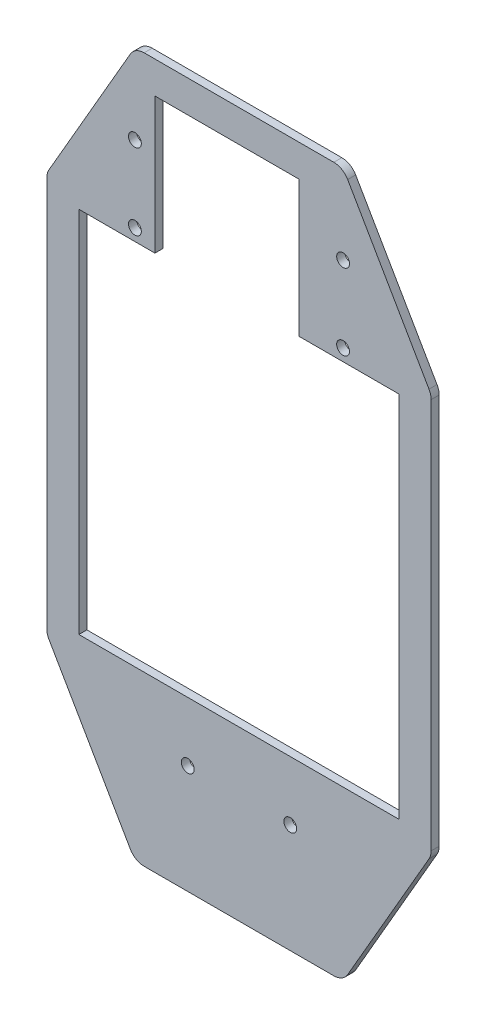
SolidWorks part; units mm, degrees
ref_plane "前视基准面" through (0, 0, 0) normal (0, 0, 1) x (1, 0, 0)
ref_plane "上视基准面" through (0, 0, 0) normal (0, 1, 0) x (1, 0, 0)
ref_plane "右视基准面" through (0, 0, 0) normal (1, 0, 0) x (0, 0, -1)
sketch "草图1" plane through (0, 0, 0) normal (0, 0, 1) x (1, 0, 0)
  line L0 (-98.6603, 121.6667) -> (-56.3212, 195)
  line L1 (47.661, 200) -> (-47.661, 200)
  line L2 (100, 116.6667) -> (100, -116.6667)
  line L3 (47.661, -200) -> (-47.661, -200)
  line L4 (-100, 116.6667) -> (-100, -116.6667)
  line L5 (-118.6603, 127.0257) -> (-67.8682, 215)
  line L6 (59.208, 220) -> (-59.208, 220)
  line L7 (0, 0) -> (0, 150) construction
  line L8 (0, 0) -> (100, 0) construction
  line L9 (98.6603, 121.6667) -> (56.3212, 195)
  line L10 (98.6603, -121.6667) -> (56.3212, -195)
  line L11 (-98.6603, -121.6667) -> (-56.3212, -195)
  line L12 (118.6603, 127.0257) -> (67.8682, 215)
  line L13 (120, 122.0257) -> (120, -122.0257)
  line L14 (118.6603, -127.0257) -> (67.8682, -215)
  line L15 (59.208, -220) -> (-59.208, -220)
  line L16 (-118.6603, -127.0257) -> (-67.8682, -215)
  line L17 (-120, 122.0257) -> (-120, -122.0257)
  line L18 (-120, -124.7051) -> (-64.9815, -220) construction
  line L19 (-120, 124.7051) -> (-120, -124.7051) construction
  line L20 (64.9815, -220) -> (-64.9815, -220) construction
  line L21 (120, -124.7051) -> (64.9815, -220) construction
  line L22 (120, 124.7051) -> (120, -124.7051) construction
  line L23 (-100, -119.3462) -> (-53.4345, -200) construction
  line L24 (53.4345, -200) -> (-53.4345, -200) construction
  line L25 (-100, 119.3462) -> (-100, -119.3462) construction
  line L26 (100, -119.3462) -> (53.4345, -200) construction
  line L27 (100, 119.3462) -> (100, -119.3462) construction
  line L28 (100, 119.3462) -> (53.4345, 200) construction
  line L29 (53.4345, 200) -> (-53.4345, 200) construction
  line L30 (-100, 119.3462) -> (-53.4345, 200) construction
  line L31 (120, 124.7051) -> (64.9815, 220) construction
  line L32 (64.9815, 220) -> (-64.9815, 220) construction
  line L33 (-120, 124.7051) -> (-64.9815, 220) construction
  arc A0 (-118.6603, -127.0257) -> (-120, -122.0257) centre (-110, -122.0257) cw
  arc A1 (-59.208, -220) -> (-67.8682, -215) centre (-59.208, -210) cw
  arc A2 (67.8682, -215) -> (59.208, -220) centre (59.208, -210) cw
  arc A3 (120, -122.0257) -> (118.6603, -127.0257) centre (110, -122.0257) cw
  arc A4 (-56.3212, -195) -> (-47.661, -200) centre (-47.661, -190) ccw
  arc A5 (-98.6603, -121.6667) -> (-100, -116.6667) centre (-90, -116.6667) cw
  arc A6 (56.3212, -195) -> (47.661, -200) centre (47.661, -190) cw
  arc A7 (98.6603, -121.6667) -> (100, -116.6667) centre (90, -116.6667) ccw
  arc A8 (56.3212, 195) -> (47.661, 200) centre (47.661, 190) ccw
  arc A9 (98.6603, 121.6667) -> (100, 116.6667) centre (90, 116.6667) cw
  arc A10 (-56.3212, 195) -> (-47.661, 200) centre (-47.661, 190) cw
  arc A11 (-98.6603, 121.6667) -> (-100, 116.6667) centre (-90, 116.6667) ccw
  arc A12 (118.6603, 127.0257) -> (120, 122.0257) centre (110, 122.0257) cw
  arc A13 (59.208, 220) -> (67.8682, 215) centre (59.208, 210) cw
  arc A14 (-67.8682, 215) -> (-59.208, 220) centre (-59.208, 210) cw
  arc A15 (-118.6603, 127.0257) -> (-120, 122.0257) centre (-110, 122.0257) ccw
  point P0 (0, 0)
  point P37 (-53.4345, -200)
  point P50 (53.4345, 200)
  dimension "D6" = 10
  dimension "D7" = 73.3333
  dimension "D1" = 400
  dimension "D2" = 200
  dimension "D3" = 100
  dimension "D4" = 200
  dimension "D5" = 20
  dimension "D8" = 30
  dimension "D9" = 73.3333
  dimension "D10" = 30
extrude "凸台-拉伸1" add sketch "草图1" along normal blind 30
sketch "草图2" plane through (0, 0, 30) normal (0, 0, 1) x (1, 0, 0)
  line L0 (-100, 130) -> (-70, 130)
  line L1 (-100, 116.6667) -> (-100, -116.6667) construction
  line L2 (-70, 130) -> (-70, 200)
  line L3 (47.661, 200) -> (-47.661, 200) construction
  line L4 (-70, 200) -> (-37.5, 200)
  line L5 (-37.5, 200) -> (-37.5, 115)
  line L6 (-37.5, 115) -> (-100, 115)
  line L7 (-100, 115) -> (-100, 130)
  line L8 (0, 0) -> (0, 200) construction
  dimension "D1" = 15
  dimension "D2" = 32.5
  dimension "D3" = 37.5
  dimension "D4" = 115
extrude "凸台-拉伸2" add sketch "草图2" against normal blind 40
mirror "镜向1" about plane through (0, 0, 0) normal (0, 1, 0) of "凸台-拉伸2"
mirror "镜向2" about plane through (0, 0, 0) normal (1, 0, 0) of "凸台-拉伸2", "镜向1"
sketch "草图3" plane through (0, 0, 0) normal (0, 0, -1) x (-1, 0, 0)
  line L0 (-100, 115) -> (100, 115)
  line L1 (100, 115) -> (100, -115)
  line L2 (100, -115) -> (-100, -115)
  line L3 (-100, -115) -> (-100, 115)
  line L8 (120, -122.0257) -> (120, 122.0257)
  line L10 (120, -122.0257) -> (120, 122.0257)
  line L12 (-120, 122.0257) -> (-120, -122.0257)
  line L13 (-118.6603, -127.0257) -> (-67.8682, -215)
  line L14 (118.6603, 127.0257) -> (67.8682, 215)
  line L20 (-120, 122.0257) -> (-120, -122.0257)
  line L21 (-118.6603, -127.0257) -> (-67.8682, -215)
  line L28 (118.6603, 127.0257) -> (67.8682, 215)
  line L29 (59.208, 220) -> (-59.208, 220)
  line L30 (59.208, 220) -> (-59.208, 220)
  line L31 (-67.8682, 215) -> (-118.6603, 127.0257)
  line L32 (-67.8682, 215) -> (-118.6603, 127.0257)
  line L34 (-59.208, -220) -> (59.208, -220)
  line L36 (-59.208, -220) -> (59.208, -220)
  line L38 (67.8682, -215) -> (118.6603, -127.0257)
  line L40 (67.8682, -215) -> (118.6603, -127.0257)
  arc A8 (118.6603, -127.0257) -> (120, -122.0257) centre (110, -122.0257) ccw
  arc A9 (118.6603, -127.0257) -> (120, -122.0257) centre (110, -122.0257) ccw
  arc A10 (120, 122.0257) -> (118.6603, 127.0257) centre (110, 122.0257) ccw
  arc A11 (120, 122.0257) -> (118.6603, 127.0257) centre (110, 122.0257) ccw
  arc A12 (-118.6603, 127.0257) -> (-120, 122.0257) centre (-110, 122.0257) ccw
  arc A13 (-120, -122.0257) -> (-118.6603, -127.0257) centre (-110, -122.0257) ccw
  arc A14 (67.8682, 215) -> (59.208, 220) centre (59.208, 210) ccw
  arc A15 (67.8682, 215) -> (59.208, 220) centre (59.208, 210) ccw
  arc A20 (-118.6603, 127.0257) -> (-120, 122.0257) centre (-110, 122.0257) ccw
  arc A21 (-120, -122.0257) -> (-118.6603, -127.0257) centre (-110, -122.0257) ccw
  arc A24 (-59.208, 220) -> (-67.8682, 215) centre (-59.208, 210) ccw
  arc A25 (-59.208, 220) -> (-67.8682, 215) centre (-59.208, 210) ccw
  arc A26 (-67.8682, -215) -> (-59.208, -220) centre (-59.208, -210) ccw
  arc A27 (-67.8682, -215) -> (-59.208, -220) centre (-59.208, -210) ccw
  arc A28 (59.208, -220) -> (67.8682, -215) centre (59.208, -210) ccw
  arc A29 (59.208, -220) -> (67.8682, -215) centre (59.208, -210) ccw
  dimension "D1" = 0
extrude "凸台-拉伸3" add sketch "草图3" along normal blind 20
sketch "草图5" plane through (0, 0, -20) normal (0, 0, -1) x (-1, 0, 0)
  line L0 (-67.8682, 215) -> (-67.8682, 310)
  line L1 (-67.8682, 310) -> (67.8682, 310)
  line L2 (67.8682, 310) -> (67.8682, 215)
  line L3 (59.208, 220) -> (-59.208, 220) construction
  line L4 (59.208, 220) -> (-59.208, 220)
  arc A0 (67.8682, 215) -> (59.208, 220) centre (59.208, 210) ccw construction
  arc A1 (-59.208, 220) -> (-67.8682, 215) centre (-59.208, 210) ccw construction
  arc A2 (67.8682, 215) -> (59.208, 220) centre (59.208, 210) ccw
  arc A3 (-59.208, 220) -> (-67.8682, 215) centre (-59.208, 210) ccw
  dimension "D1" = 90
extrude "凸台-拉伸11" add sketch "草图5" against normal blind 15 from offset 10
fillet "圆角3" radius 5 2 edges at (67.8682, 310, -2.5) (-67.8682, 310, -2.5)
sketch "草图6" plane through (0, 0, 0) normal (1, 0, 0) x (0, 0, -1)
  line L0 (-30, 220) -> (-5, 220) construction
  line L1 (17, 221) -> (-5, 221)
  line L2 (17, 221) -> (17, 199)
  line L3 (17, 199) -> (-5, 199)
  line L4 (-5, 221) -> (-5, 199)
  line L5 (17, 221) -> (-5, 199) construction
  line L6 (17, 199) -> (-5, 221) construction
  line L7 (-30, 127.0257) -> (-30, 215) construction
  point P0 (6, 210)
  dimension "D1" = 22
  dimension "D2" = 10
  dimension "D3" = 22
  dimension "D4" = 25
extrude "凸台-拉伸12" add sketch "草图6" along normal mid plane 450
sketch "草图10" plane through (0, 0, 30) normal (0, 0, 1) x (1, 0, 0)
  line L0 (-65, 122.5) -> (-65, 170) construction
  line L2 (-100, 115) -> (-37.5, 115) construction
  dimension "D1" = 65
  dimension "D2" = 7.5
  dimension "D3" = 47.5
hole_wizard "M8x1.0 螺纹孔1" positions "3D草图1" profile "草图11" tap size "M8x1.0" standard "GB"
sketch3d "3D草图1"
  point P0 (-65, 122.5, 30)
  point P3 (-65, 170, 30)
sketch "草图11" plane through (-65, 122.5, 30) normal (1, 0, 0) x (0, -1, 0)
  line L0 (0, 0) -> (0, 23.103)
  line L1 (0, 23.103) -> (3.5, 21)
  line L2 (3.5, 21) -> (3.5, 0)
  line L5 (3.5, 0) -> (0, 0)
  line L10 (0, 23.103) -> (-3.5, 21) construction
  line L11 (0, -6.35) -> (0, 107.95) construction
  dimension "螺纹孔钻头直径" = 7
  dimension "螺纹孔钻头深度" = 21
  dimension "导头角度" = 118
mirror "镜向7" about plane through (0, 0, 0) normal (1, 0, 0) of "M8x1.0 螺纹孔1"
sketch "草图14" plane through (0, 0, 0) normal (0, 0, 1) x (1, 0, 0)
  line L0 (-37.5, 200) -> (37.5, 200)
  line L1 (37.5, 200) -> (37.5, 199)
  line L2 (37.5, 199) -> (-37.5, 199)
  line L3 (-37.5, 199) -> (-37.5, 200)
extrude "切除-拉伸1" cut sketch "草图14" along normal blind 10
mirror "镜向8" about plane through (0, 0, 0) normal (0, 1, 0) of "切除-拉伸1", "凸台-拉伸12", "凸台-拉伸11"
sketch "草图15" plane through (0, 0, 5) normal (0, 0, 1) x (1, 0, 0)
  line L0 (225, 210) -> (191, 210) construction
  line L1 (194, 213) -> (188, 213)
  line L2 (194, 213) -> (194, 207)
  line L3 (194, 207) -> (188, 207)
  line L4 (188, 213) -> (188, 207)
  line L5 (194, 213) -> (188, 207) construction
  line L6 (194, 207) -> (188, 213) construction
  line L7 (225, 221) -> (225, 199) construction
  line L8 (191, 210) -> (176, 210) construction
  line L10 (179, 213) -> (173, 213)
  line L11 (179, 213) -> (179, 207)
  line L12 (179, 207) -> (173, 207)
  line L13 (173, 213) -> (173, 207)
  line L14 (179, 213) -> (173, 207) construction
  line L15 (179, 207) -> (173, 213) construction
  point P0 (191, 210)
  dimension "D1" = 6
  dimension "D2" = 6
  dimension "D3" = 34
  dimension "D4" = 15
  dimension "D5" = 6
  dimension "D6" = 6
sketch "草图16" plane through (0, 0, 5) normal (0, 0, 1) x (1, 0, 0)
  line L0 (135, 199) -> (135, -199)
  line L1 (225, 199) -> (77.1058, 199) construction
  line L2 (225, -199) -> (77.1058, -199) construction
  line L3 (135, -199) -> (77.1058, -199)
  line L4 (77.1058, -199) -> (118.6603, -127.0257)
  line L5 (120, -122.0257) -> (120, 122.0257) construction
  line L6 (120, -122.0257) -> (120, 122.0257)
  line L7 (118.6603, 127.0257) -> (67.8682, 215) construction
  line L8 (118.6603, 127.0257) -> (77.1058, 199)
  line L9 (135, 199) -> (77.1058, 199)
  line L10 (0, 0) -> (0, -200) construction
  line L11 (-37.5, -200) -> (37.5, -200) construction
  line L12 (-135, 199) -> (-77.1058, 199)
  line L13 (-118.6603, 127.0257) -> (-77.1058, 199)
  line L14 (-120, -122.0257) -> (-120, 122.0257)
  line L15 (-77.1058, -199) -> (-118.6603, -127.0257)
  line L16 (-135, -199) -> (-77.1058, -199)
  line L17 (-135, 199) -> (-135, -199)
  arc A0 (118.6603, -127.0257) -> (120, -122.0257) centre (110, -122.0257) ccw construction
  arc A1 (118.6603, -127.0257) -> (120, -122.0257) centre (110, -122.0257) ccw
  arc A2 (120, 122.0257) -> (118.6603, 127.0257) centre (110, 122.0257) ccw construction
  arc A3 (120, 122.0257) -> (118.6603, 127.0257) centre (110, 122.0257) ccw
  arc A4 (-120, 122.0257) -> (-118.6603, 127.0257) centre (-110, 122.0257) cw
  arc A5 (-118.6603, -127.0257) -> (-120, -122.0257) centre (-110, -122.0257) cw
  dimension "D1" = 15
extrude "凸台-拉伸13" add sketch "草图16" against normal blind 20 from offset 1
sketch "草图17" plane through (0, 0, 4) normal (0, 0, 1) x (1, 0, 0)
  line L0 (105.9734, 199) -> (135, 148.7244)
  line L1 (135, 199) -> (77.1058, 199) construction
  line L2 (135, -199) -> (135, 199) construction
  line L3 (135, 148.7244) -> (135, 199)
  line L4 (225, 199) -> (77.1058, 199) construction
  line L5 (135, 199) -> (105.9734, 199)
  line L6 (77.1058, 199) -> (118.6603, 127.0257) construction
  line L7 (118.6603, 127.0257) -> (67.8682, 215) construction
  line L8 (0, 0) -> (308.3014, 0) construction
  line L9 (135, -199) -> (105.9734, -199)
  line L10 (135, -148.7244) -> (135, -199)
  line L11 (105.9734, -199) -> (135, -148.7244)
  line L12 (0, 0) -> (0, -200) construction
  line L13 (-37.5, -200) -> (37.5, -200) construction
  line L14 (-105.9734, -199) -> (-135, -148.7244)
  line L15 (-135, -148.7244) -> (-135, -199)
  line L16 (-135, -199) -> (-105.9734, -199)
  line L17 (-135, 199) -> (-105.9734, 199)
  line L18 (-135, 148.7244) -> (-135, 199)
  line L19 (-105.9734, 199) -> (-135, 148.7244)
  dimension "D1" = 25
extrude "切除-拉伸3" cut sketch "草图17" against normal blind 20
fillet "圆角4" radius 5 8 edges at (105.9734, -199, -6) (135, -148.7244, -6) (135, 148.7244, -6) (105.9734, 199, -6) (-105.9734, 199, -6) (-135, 148.7244, -6) (-135, -148.7244, -6) (-105.9734, -199, -6)
sketch "草图18" plane through (225, 0, 0) normal (1, 0, 0) x (0, 0, -1)
  line L0 (-5, 199) -> (17, 199) construction
  line L1 (8, 203) -> (4, 203)
  line L2 (8, 203) -> (8, 195)
  line L3 (8, 195) -> (4, 195)
  line L4 (4, 203) -> (4, 195)
  line L5 (8, 203) -> (4, 195) construction
  line L6 (8, 195) -> (4, 203) construction
  point P0 (6, 199)
  dimension "D1" = 8
  dimension "D2" = 4
sketch "草图19" plane through (0, 0, 30) normal (0, 0, 1) x (1, 0, 0)
  line L3 (-93.849, 130) -> (-70, 130)
  line L4 (-70, 130) -> (-70, 171.3077)
  line L5 (-70, 171.3077) -> (-93.849, 130)
  line L6 (-93.849, 130) -> (-70, 130)
  line L7 (-70, 130) -> (-70, 171.3077)
  line L8 (-70, 171.3077) -> (-93.849, 130)
  line L9 (93.849, 130) -> (70, 171.3077)
  line L10 (70, 171.3077) -> (70, 130)
  line L11 (70, 130) -> (93.849, 130)
  line L12 (93.849, 130) -> (70, 171.3077)
  line L13 (70, 171.3077) -> (70, 130)
  line L14 (70, 130) -> (93.849, 130)
  line L15 (93.849, -130) -> (70, -130)
  line L16 (70, -130) -> (70, -171.3077)
  line L17 (70, -171.3077) -> (93.849, -130)
  line L18 (93.849, -130) -> (70, -130)
  line L19 (70, -130) -> (70, -171.3077)
  line L20 (70, -171.3077) -> (93.849, -130)
  line L21 (-93.849, -130) -> (-70, -171.3077)
  line L22 (-70, -171.3077) -> (-70, -130)
  line L23 (-70, -130) -> (-93.849, -130)
  line L24 (-93.849, -130) -> (-70, -171.3077)
  line L25 (-70, -171.3077) -> (-70, -130)
  line L26 (-70, -130) -> (-93.849, -130)
  dimension "D1" = 0
  dimension "D2" = 0
  dimension "D3" = 0
  dimension "D4" = 0
extrude "凸台-拉伸14" add sketch "草图19" against normal up to next
sketch "草图20" plane through (0, 0, -20) normal (0, 0, -1) x (-1, 0, 0)
  line L1 (-100, 115) -> (100, 115)
  line L2 (-100, 115) -> (-100, -115)
  line L3 (-100, -115) -> (100, -115)
  line L4 (100, 115) -> (100, -115)
  line L8 (120, -122.0257) -> (120, 122.0257)
  line L9 (118.6603, 127.0257) -> (67.8682, 215)
  line L10 (59.208, 220) -> (-59.208, 220)
  line L11 (-67.8682, 215) -> (-118.6603, 127.0257)
  line L12 (-120, 122.0257) -> (-120, -122.0257)
  line L13 (-118.6603, -127.0257) -> (-67.8682, -215)
  line L14 (-59.208, -220) -> (59.208, -220)
  line L15 (67.8682, -215) -> (118.6603, -127.0257)
  line L16 (120, -122.0257) -> (120, 122.0257)
  line L17 (118.6603, 127.0257) -> (67.8682, 215)
  line L18 (59.208, 220) -> (-59.208, 220)
  line L19 (-67.8682, 215) -> (-118.6603, 127.0257)
  line L20 (-120, 122.0257) -> (-120, -122.0257)
  line L21 (-118.6603, -127.0257) -> (-67.8682, -215)
  line L22 (-59.208, -220) -> (59.208, -220)
  line L23 (67.8682, -215) -> (118.6603, -127.0257)
  arc A8 (118.6603, -127.0257) -> (120, -122.0257) centre (110, -122.0257) ccw
  arc A9 (120, 122.0257) -> (118.6603, 127.0257) centre (110, 122.0257) ccw
  arc A10 (67.8682, 215) -> (59.208, 220) centre (59.208, 210) ccw
  arc A11 (-59.208, 220) -> (-67.8682, 215) centre (-59.208, 210) ccw
  arc A12 (-118.6603, 127.0257) -> (-120, 122.0257) centre (-110, 122.0257) ccw
  arc A13 (-120, -122.0257) -> (-118.6603, -127.0257) centre (-110, -122.0257) ccw
  arc A14 (-67.8682, -215) -> (-59.208, -220) centre (-59.208, -210) ccw
  arc A15 (59.208, -220) -> (67.8682, -215) centre (59.208, -210) ccw
  arc A16 (118.6603, -127.0257) -> (120, -122.0257) centre (110, -122.0257) ccw
  arc A17 (120, 122.0257) -> (118.6603, 127.0257) centre (110, 122.0257) ccw
  arc A18 (67.8682, 215) -> (59.208, 220) centre (59.208, 210) ccw
  arc A19 (-59.208, 220) -> (-67.8682, 215) centre (-59.208, 210) ccw
  arc A20 (-118.6603, 127.0257) -> (-120, 122.0257) centre (-110, 122.0257) ccw
  arc A21 (-120, -122.0257) -> (-118.6603, -127.0257) centre (-110, -122.0257) ccw
  arc A22 (-67.8682, -215) -> (-59.208, -220) centre (-59.208, -210) ccw
  arc A23 (59.208, -220) -> (67.8682, -215) centre (59.208, -210) ccw
  dimension "D1" = 0
extrude "凸台-拉伸15" add sketch "草图20" along normal blind 5
sketch "草图22" plane through (67.8682, 0, 0) normal (1, 0, 0) x (0, 0, -1)
  line L0 (10, 305) -> (10, 221) construction
  line L1 (10, 262) -> (0, 262)
  line L2 (10, 262) -> (10, 290)
  line L3 (10, 290) -> (0, 290)
  line L4 (0, 262) -> (0, 290)
  line L5 (-5, 310) -> (10, 310) construction
  line L6 (0, 264) -> (10, 266)
  line L7 (10, 272) -> (0, 274)
  line L8 (0, 276) -> (10, 276) construction
  line L9 (10, 280) -> (0, 278)
  line L10 (0, 288) -> (10, 286)
  dimension "D1" = 10
  dimension "D2" = 28
  dimension "D3" = 20
  dimension "D4" = 4
  dimension "D5" = 4
  dimension "D6" = 2
  dimension "D7" = 10
sketch "草图24" plane through (0, 0, 0) normal (0, 0, 1) x (1, 0, 0)
  line L4 (-37.5, -115) -> (-37.5, -200)
  line L7 (37.5, -115) -> (-37.5, -115)
  line L11 (37.5, -115) -> (-37.5, -115)
  line L16 (-37.5, -115) -> (-37.5, -200)
  line L19 (-37.5, -200) -> (37.5, -200)
  line L21 (-37.5, -200) -> (37.5, -200)
  line L22 (37.5, -200) -> (37.5, -115)
  line L23 (37.5, -200) -> (37.5, -115)
  dimension "D1" = 0
extrude "凸台-拉伸16" add sketch "草图24" along normal up to surface (30 mm away)
sketch "草图25" plane through (0, -115, 0) normal (0, 1, 0) x (1, 0, 0)
  line L0 (0, -30) -> (0, 22) construction
  line L1 (-100, -30) -> (100, -30) construction
  dimension "D1" = 52
hole_wizard "M8 螺纹孔1" positions "3D草图2" profile "草图26" tap size "M8" standard "GB"
sketch3d "3D草图2"
  point P0 (0, -115, -22)
sketch "草图26" plane through (0, -115, -22) normal (1, 0, 0) x (0, 0, 1)
  line L0 (0, 0) -> (0, 22.0429)
  line L1 (0, 22.0429) -> (3.4, 20)
  line L2 (3.4, 20) -> (3.4, 0)
  line L5 (3.4, 0) -> (0, 0)
  line L10 (0, 22.0429) -> (-3.4, 20) construction
  line L11 (0, -6.35) -> (0, 107.95) construction
  dimension "螺纹孔钻头直径" = 6.8
  dimension "螺纹孔钻头深度" = 20
  dimension "导头角度" = 118
sketch "草图27" plane through (0, 0, 30) normal (0, 0, 1) x (1, 0, 0)
  line L0 (-16, -115) -> (-16, -105)
  line L1 (-100, -115) -> (100, -115) construction
  line L2 (-16, -105) -> (16, -105)
  line L3 (0, -105) -> (0, -111) construction
  line L4 (12, -111) -> (-12, -111)
  line L5 (-12, -111) -> (-12, -115)
  line L6 (-12, -115) -> (-16, -115)
  line L7 (0, 0) -> (0, -105) construction
  line L8 (12, -115) -> (16, -115)
  line L9 (12, -111) -> (12, -115)
  line L10 (16, -115) -> (16, -105)
  dimension "D1" = 6
  dimension "D2" = 10
  dimension "D3" = 12
  dimension "D4" = 16
extrude "凸台-拉伸17" add sketch "草图27" against normal blind 5 from offset 12
pattern_linear "阵列(线性)2" count 2 spacing 26 along (0, 0, -1) of "凸台-拉伸17"
sketch "草图28" plane through (0, 0, 30) normal (0, 0, 1) x (1, 0, 0)
  line L0 (0, -115) -> (0, -152) construction
  line L1 (-100, -115) -> (100, -115) construction
  line L2 (0, -152) -> (-32, -152) construction
  line L3 (0, -152) -> (32, -152) construction
  dimension "D1" = 37
  dimension "D2" = 32
  dimension "D3" = 32
hole_wizard "M8 螺纹孔2" positions "3D草图3" profile "草图29" tap size "M8" standard "GB"
sketch3d "3D草图3"
  point P0 (-32, -152, 30)
  point P3 (32, -152, 30)
sketch "草图29" plane through (-32, -152, 30) normal (1, 0, 0) x (0, -1, 0)
  line L0 (0, 0) -> (0, 24.5429)
  line L1 (0, 24.5429) -> (3.4, 22.5)
  line L2 (3.4, 22.5) -> (3.4, 0)
  line L5 (3.4, 0) -> (0, 0)
  line L10 (0, 24.5429) -> (-3.4, 22.5) construction
  line L11 (0, -6.35) -> (0, 107.95) construction
  dimension "螺纹孔钻头直径" = 6.8
  dimension "螺纹孔钻头深度" = 22.5
  dimension "导头角度" = 118
sketch "草图30" plane through (-67.8682, 0, 0) normal (-1, 0, 0) x (0, 0, 1)
  line L0 (-10, -310) -> (-38.263, -300.579)
  line L1 (-57.2367, -297.5) -> (-125, -297.5)
  line L2 (-127.5, -295) -> (-127.5, -290)
  line L3 (-125, -287.5) -> (-10, -287.5)
  line L4 (-10, -221) -> (-10, -310) construction
  line L5 (-10, -287.5) -> (-10, -310)
  arc A0 (-38.263, -300.579) -> (-57.2367, -297.5) centre (-57.2367, -357.5) ccw
  arc A1 (-127.5, -290) -> (-125, -287.5) centre (-125, -290) cw
  arc A2 (-125, -297.5) -> (-127.5, -295) centre (-125, -295) cw
  point P10 (-47.5, -297.5)
  point P13 (-127.5, -287.5)
  point P16 (-127.5, -297.5)
  dimension "D5" = 60
  dimension "D6" = 2.5
  dimension "D1" = 12.5
  dimension "D2" = 10
  dimension "D3" = 117.5
  dimension "D4" = 80
sketch "草图32" plane through (0, 0, 30) normal (0, 0, 1) x (1, 0, 0)
  line L0 (-37.5, 200) -> (-52.5, 200)
  line L1 (-52.5, 200) -> (-52.5, 115)
  line L2 (-100, 115) -> (-37.5, 115) construction
  line L3 (-52.5, 115) -> (-37.5, 115)
  line L4 (-37.5, 115) -> (-37.5, 200)
  dimension "D1" = 15
extrude "切除-拉伸7" cut sketch "草图32" against normal up to surface (30 mm away)
sketch "草图33" plane through (0, 0, 0) normal (0, 0, 1) x (1, 0, 0)
  line L4 (37.5, 115) -> (37.5, 200)
  line L6 (-52.5, 200) -> (-52.5, 115)
  line L7 (-52.5, 115) -> (37.5, 115)
  line L10 (-52.5, 200) -> (-52.5, 115)
  line L11 (-52.5, 115) -> (37.5, 115)
  line L12 (37.5, 115) -> (37.5, 200)
  line L14 (37.5, 200) -> (-52.5, 200)
  line L15 (37.5, 200) -> (-52.5, 200)
  dimension "D1" = 0
extrude "切除-拉伸8" cut sketch "草图33" against normal blind 12
sketch "草图34" plane through (0, 0, 30) normal (0, 0, 1) x (1, 0, 0)
  line L0 (-100, -115) -> (100, -115) construction
  line L1 (-50, -115) -> (50, -115)
  line L2 (-50, -115) -> (-50, -174)
  line L3 (-50, -174) -> (50, -174)
  line L4 (50, -115) -> (50, -174)
  line L5 (0, -174) -> (0, -220) construction
  line L6 (59.208, -220) -> (-59.208, -220) construction
  dimension "D1" = 100
  dimension "D2" = 59
extrude "切除-拉伸9" cut sketch "草图34" against normal blind 9.25
sketch "草图35" plane through (0, 0, 30) normal (0, 0, 1) x (1, 0, 0)
  line L2 (-175.1264, 290.7759) -> (175.1264, 290.7759)
  line L3 (-175.1264, 290.7759) -> (-175.1264, -290.7759)
  line L4 (-175.1264, -290.7759) -> (175.1264, -290.7759)
  line L5 (175.1264, 290.7759) -> (175.1264, -290.7759)
  line L6 (-175.1264, 290.7759) -> (175.1264, -290.7759) construction
  line L7 (-175.1264, -290.7759) -> (175.1264, 290.7759) construction
  point P2 (0, 0)
extrude "切除-拉伸10" cut sketch "草图35" against normal offset from surface (21 mm away) 5
sketch "草图40" plane through (0, 0, -25) normal (0, 0, -1) x (-1, 0, 0)
  line L1 (-294.8809, 339.2041) -> (294.8809, 339.2041)
  line L2 (-294.8809, 339.2041) -> (-294.8809, -339.2041)
  line L3 (-294.8809, -339.2041) -> (294.8809, -339.2041)
  line L4 (294.8809, 339.2041) -> (294.8809, -339.2041)
  line L5 (-294.8809, 339.2041) -> (294.8809, -339.2041) construction
  line L6 (-294.8809, -339.2041) -> (294.8809, 339.2041) construction
  point P0 (0, 0)
sketch "草图42" plane through (0, 0, -25) normal (0, 0, -1) x (-1, 0, 0)
  line L8 (120, -122.0257) -> (120, 122.0257)
  line L9 (118.6603, 127.0257) -> (67.8682, 215)
  line L10 (59.208, 220) -> (-59.208, 220)
  line L11 (-67.8682, 215) -> (-118.6603, 127.0257)
  line L12 (-120, 122.0257) -> (-120, -122.0257)
  line L13 (-118.6603, -127.0257) -> (-67.8682, -215)
  line L14 (-59.208, -220) -> (59.208, -220)
  line L15 (67.8682, -215) -> (118.6603, -127.0257)
  line L16 (120, -122.0257) -> (120, 122.0257)
  line L17 (118.6603, 127.0257) -> (67.8682, 215)
  line L18 (59.208, 220) -> (-59.208, 220)
  line L19 (-67.8682, 215) -> (-118.6603, 127.0257)
  line L20 (-120, 122.0257) -> (-120, -122.0257)
  line L21 (-118.6603, -127.0257) -> (-67.8682, -215)
  line L22 (-59.208, -220) -> (59.208, -220)
  line L23 (67.8682, -215) -> (118.6603, -127.0257)
  arc A8 (118.6603, -127.0257) -> (120, -122.0257) centre (110, -122.0257) ccw
  arc A9 (120, 122.0257) -> (118.6603, 127.0257) centre (110, 122.0257) ccw
  arc A10 (67.8682, 215) -> (59.208, 220) centre (59.208, 210) ccw
  arc A11 (-59.208, 220) -> (-67.8682, 215) centre (-59.208, 210) ccw
  arc A12 (-118.6603, 127.0257) -> (-120, 122.0257) centre (-110, 122.0257) ccw
  arc A13 (-120, -122.0257) -> (-118.6603, -127.0257) centre (-110, -122.0257) ccw
  arc A14 (-67.8682, -215) -> (-59.208, -220) centre (-59.208, -210) ccw
  arc A15 (59.208, -220) -> (67.8682, -215) centre (59.208, -210) ccw
  arc A16 (118.6603, -127.0257) -> (120, -122.0257) centre (110, -122.0257) ccw
  arc A17 (120, 122.0257) -> (118.6603, 127.0257) centre (110, 122.0257) ccw
  arc A18 (67.8682, 215) -> (59.208, 220) centre (59.208, 210) ccw
  arc A19 (-59.208, 220) -> (-67.8682, 215) centre (-59.208, 210) ccw
  arc A20 (-118.6603, 127.0257) -> (-120, 122.0257) centre (-110, 122.0257) ccw
  arc A21 (-120, -122.0257) -> (-118.6603, -127.0257) centre (-110, -122.0257) ccw
  arc A22 (-67.8682, -215) -> (-59.208, -220) centre (-59.208, -210) ccw
  arc A23 (59.208, -220) -> (67.8682, -215) centre (59.208, -210) ccw
  dimension "D1" = 0
sketch "草图43" plane through (0, 0, -25) normal (0, 0, -1) x (-1, 0, 0)
  line L1 (-227.3114, 369.6277) -> (227.3114, 369.6277)
  line L2 (-227.3114, 369.6277) -> (-227.3114, -369.6277)
  line L3 (-227.3114, -369.6277) -> (227.3114, -369.6277)
  line L4 (227.3114, 369.6277) -> (227.3114, -369.6277)
  line L5 (-227.3114, 369.6277) -> (227.3114, -369.6277) construction
  line L6 (-227.3114, -369.6277) -> (227.3114, 369.6277) construction
  line L8 (120, -122.0257) -> (120, 122.0257)
  line L9 (118.6603, 127.0257) -> (67.8682, 215)
  line L10 (59.208, 220) -> (-59.208, 220)
  line L11 (-67.8682, 215) -> (-118.6603, 127.0257)
  line L12 (-120, 122.0257) -> (-120, -122.0257)
  line L13 (-118.6603, -127.0257) -> (-67.8682, -215)
  line L14 (-59.208, -220) -> (59.208, -220)
  line L15 (67.8682, -215) -> (118.6603, -127.0257)
  line L16 (120, -122.0257) -> (120, 122.0257)
  line L17 (118.6603, 127.0257) -> (67.8682, 215)
  line L18 (59.208, 220) -> (-59.208, 220)
  line L19 (-67.8682, 215) -> (-118.6603, 127.0257)
  line L20 (-120, 122.0257) -> (-120, -122.0257)
  line L21 (-118.6603, -127.0257) -> (-67.8682, -215)
  line L22 (-59.208, -220) -> (59.208, -220)
  line L23 (67.8682, -215) -> (118.6603, -127.0257)
  arc A8 (118.6603, -127.0257) -> (120, -122.0257) centre (110, -122.0257) ccw
  arc A9 (120, 122.0257) -> (118.6603, 127.0257) centre (110, 122.0257) ccw
  arc A10 (67.8682, 215) -> (59.208, 220) centre (59.208, 210) ccw
  arc A11 (-59.208, 220) -> (-67.8682, 215) centre (-59.208, 210) ccw
  arc A12 (-118.6603, 127.0257) -> (-120, 122.0257) centre (-110, 122.0257) ccw
  arc A13 (-120, -122.0257) -> (-118.6603, -127.0257) centre (-110, -122.0257) ccw
  arc A14 (-67.8682, -215) -> (-59.208, -220) centre (-59.208, -210) ccw
  arc A15 (59.208, -220) -> (67.8682, -215) centre (59.208, -210) ccw
  arc A16 (118.6603, -127.0257) -> (120, -122.0257) centre (110, -122.0257) ccw
  arc A17 (120, 122.0257) -> (118.6603, 127.0257) centre (110, 122.0257) ccw
  arc A18 (67.8682, 215) -> (59.208, 220) centre (59.208, 210) ccw
  arc A19 (-59.208, 220) -> (-67.8682, 215) centre (-59.208, 210) ccw
  arc A20 (-118.6603, 127.0257) -> (-120, 122.0257) centre (-110, 122.0257) ccw
  arc A21 (-120, -122.0257) -> (-118.6603, -127.0257) centre (-110, -122.0257) ccw
  arc A22 (-67.8682, -215) -> (-59.208, -220) centre (-59.208, -210) ccw
  arc A23 (59.208, -220) -> (67.8682, -215) centre (59.208, -210) ccw
  point P0 (0, 0)
  dimension "D1" = 0
sketch "草图45" plane through (0, 0, -25) normal (0, 0, -1) x (-1, 0, 0)
  line L1 (-183.5965, 287.6082) -> (183.5965, 287.6082)
  line L2 (-183.5965, 287.6082) -> (-183.5965, -287.6082)
  line L3 (-183.5965, -287.6082) -> (183.5965, -287.6082)
  line L4 (183.5965, 287.6082) -> (183.5965, -287.6082)
  line L5 (-183.5965, 287.6082) -> (183.5965, -287.6082) construction
  line L6 (-183.5965, -287.6082) -> (183.5965, 287.6082) construction
  point P0 (0, 0)
sketch "草图52" plane through (0, 0, 9) normal (0, 0, 1) x (1, 0, 0)
  line L8 (59.208, 220) -> (-59.208, 220)
  line L9 (-67.8682, 215) -> (-118.6603, 127.0257)
  line L10 (-120, 122.0257) -> (-120, -122.0257)
  line L11 (-118.6603, -127.0257) -> (-67.8682, -215)
  line L12 (-59.208, -220) -> (59.208, -220)
  line L13 (67.8682, -215) -> (118.6603, -127.0257)
  line L14 (120, -122.0257) -> (120, 122.0257)
  line L15 (118.6603, 127.0257) -> (67.8682, 215)
  line L16 (59.208, 220) -> (-59.208, 220)
  line L17 (-67.8682, 215) -> (-118.6603, 127.0257)
  line L18 (-120, 122.0257) -> (-120, -122.0257)
  line L19 (-118.6603, -127.0257) -> (-67.8682, -215)
  line L20 (-59.208, -220) -> (59.208, -220)
  line L21 (67.8682, -215) -> (118.6603, -127.0257)
  line L22 (120, -122.0257) -> (120, 122.0257)
  line L23 (118.6603, 127.0257) -> (67.8682, 215)
  arc A8 (-59.208, 220) -> (-67.8682, 215) centre (-59.208, 210) ccw
  arc A9 (-118.6603, 127.0257) -> (-120, 122.0257) centre (-110, 122.0257) ccw
  arc A10 (-120, -122.0257) -> (-118.6603, -127.0257) centre (-110, -122.0257) ccw
  arc A11 (-67.8682, -215) -> (-59.208, -220) centre (-59.208, -210) ccw
  arc A12 (59.208, -220) -> (67.8682, -215) centre (59.208, -210) ccw
  arc A13 (118.6603, -127.0257) -> (120, -122.0257) centre (110, -122.0257) ccw
  arc A14 (120, 122.0257) -> (118.6603, 127.0257) centre (110, 122.0257) ccw
  arc A15 (67.8682, 215) -> (59.208, 220) centre (59.208, 210) ccw
  arc A16 (-59.208, 220) -> (-67.8682, 215) centre (-59.208, 210) ccw
  arc A17 (-118.6603, 127.0257) -> (-120, 122.0257) centre (-110, 122.0257) ccw
  arc A18 (-120, -122.0257) -> (-118.6603, -127.0257) centre (-110, -122.0257) ccw
  arc A19 (-67.8682, -215) -> (-59.208, -220) centre (-59.208, -210) ccw
  arc A20 (59.208, -220) -> (67.8682, -215) centre (59.208, -210) ccw
  arc A21 (118.6603, -127.0257) -> (120, -122.0257) centre (110, -122.0257) ccw
  arc A22 (120, 122.0257) -> (118.6603, 127.0257) centre (110, 122.0257) ccw
  arc A23 (67.8682, 215) -> (59.208, 220) centre (59.208, 210) ccw
  dimension "D1" = 0
sketch "草图53" plane through (0, 0, 9) normal (0, 0, 1) x (1, 0, 0)
  line L1 (-373.4967, 367.981) -> (373.4967, 367.981)
  line L2 (-373.4967, 367.981) -> (-373.4967, -367.981)
  line L3 (-373.4967, -367.981) -> (373.4967, -367.981)
  line L4 (373.4967, 367.981) -> (373.4967, -367.981)
  line L5 (-373.4967, 367.981) -> (373.4967, -367.981) construction
  line L6 (-373.4967, -367.981) -> (373.4967, 367.981) construction
  point P0 (0, 0)
extrude "切除-拉伸26" cut sketch "草图53" against normal blind 110 from offset 5
sketch "草图54" plane through (0, 0, 9) normal (0, 0, 1) x (1, 0, 0)
  line L8 (59.208, 220) -> (-59.208, 220)
  line L9 (-67.8682, 215) -> (-118.6603, 127.0257)
  line L10 (-120, 122.0257) -> (-120, -122.0257)
  line L11 (-118.6603, -127.0257) -> (-67.8682, -215)
  line L12 (-59.208, -220) -> (59.208, -220)
  line L13 (67.8682, -215) -> (118.6603, -127.0257)
  line L14 (120, -122.0257) -> (120, 122.0257)
  line L15 (118.6603, 127.0257) -> (67.8682, 215)
  line L16 (59.208, 220) -> (-59.208, 220)
  line L17 (-67.8682, 215) -> (-118.6603, 127.0257)
  line L18 (-120, 122.0257) -> (-120, -122.0257)
  line L19 (-118.6603, -127.0257) -> (-67.8682, -215)
  line L20 (-59.208, -220) -> (59.208, -220)
  line L21 (67.8682, -215) -> (118.6603, -127.0257)
  line L22 (120, -122.0257) -> (120, 122.0257)
  line L23 (118.6603, 127.0257) -> (67.8682, 215)
  arc A8 (-59.208, 220) -> (-67.8682, 215) centre (-59.208, 210) ccw
  arc A9 (-118.6603, 127.0257) -> (-120, 122.0257) centre (-110, 122.0257) ccw
  arc A10 (-120, -122.0257) -> (-118.6603, -127.0257) centre (-110, -122.0257) ccw
  arc A11 (-67.8682, -215) -> (-59.208, -220) centre (-59.208, -210) ccw
  arc A12 (59.208, -220) -> (67.8682, -215) centre (59.208, -210) ccw
  arc A13 (118.6603, -127.0257) -> (120, -122.0257) centre (110, -122.0257) ccw
  arc A14 (120, 122.0257) -> (118.6603, 127.0257) centre (110, 122.0257) ccw
  arc A15 (67.8682, 215) -> (59.208, 220) centre (59.208, 210) ccw
  arc A16 (-59.208, 220) -> (-67.8682, 215) centre (-59.208, 210) ccw
  arc A17 (-118.6603, 127.0257) -> (-120, 122.0257) centre (-110, 122.0257) ccw
  arc A18 (-120, -122.0257) -> (-118.6603, -127.0257) centre (-110, -122.0257) ccw
  arc A19 (-67.8682, -215) -> (-59.208, -220) centre (-59.208, -210) ccw
  arc A20 (59.208, -220) -> (67.8682, -215) centre (59.208, -210) ccw
  arc A21 (118.6603, -127.0257) -> (120, -122.0257) centre (110, -122.0257) ccw
  arc A22 (120, 122.0257) -> (118.6603, 127.0257) centre (110, 122.0257) ccw
  arc A23 (67.8682, 215) -> (59.208, 220) centre (59.208, 210) ccw
  dimension "D1" = 0
extrude "切除-拉伸27" cut sketch "草图54" against normal blind 110 flip side to cut
sketch "草图57" plane through (0, 0, 9) normal (0, 0, 1) x (1, 0, 0)
  circle A0 centre (65, 122.5) radius 4
  circle A1 centre (65, 170) radius 4
  circle A2 centre (32, -152) radius 4
  dimension "D1" = 8
  dimension "D2" = 8
  dimension "D3" = 8
extrude "切除-拉伸28" cut sketch "草图57" against normal blind 10
mirror "镜向9" about plane through (0, 0, 0) normal (1, 0, 0) of "切除-拉伸28"
equation "\"F\"=542"
